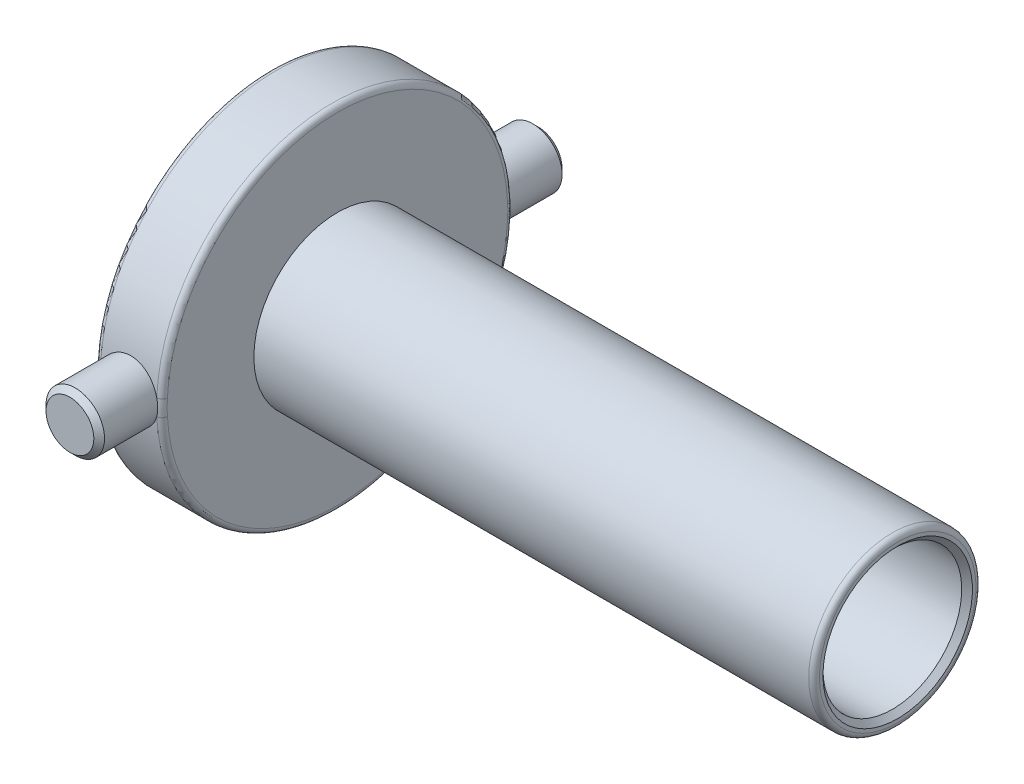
SolidWorks part; units mm, degrees
ref_plane "Front Plane" through (0, 0, 0) normal (0, 0, 1) x (1, 0, 0)
ref_plane "Top Plane" through (0, 0, 0) normal (0, 1, 0) x (1, 0, 0)
ref_plane "Right Plane" through (0, 0, 0) normal (1, 0, 0) x (0, 0, -1)
sketch "Sketch2" plane through (0, 0, 0) normal (0, 0, 1) x (1, 0, 0)
  line L0 (5.08, 5.2705) -> (47.625, 5.2705)
  line L1 (47.625, 5.2705) -> (47.625, 6.35)
  line L2 (47.625, 6.35) -> (5.08, 6.35)
  line L3 (5.08, 5.2705) -> (5.08, 0)
  line L5 (5.08, 0) -> (0, 0)
  line L6 (0, 13.335) -> (0, 0)
  line L7 (0, 0) -> (69.1724, 0) construction
  line L8 (5.08, 6.35) -> (5.08, 13.335)
  line L9 (5.08, 13.335) -> (0, 13.335)
  dimension "D1" = 5.08
  dimension "D2" = 47.625
  dimension "D3" = 10.541
  dimension "D4" = 12.7
  dimension "D5" = 26.67
revolve "Revolve1" add sketch "Sketch2" angle 360 about L7
sketch "Sketch3" plane through (0, 0, 0) normal (0, 0, 1) x (1, 0, 0)
  line L0 (0, 0) -> (5.08, 0) construction
  line L1 (0, 13.335) -> (0, -13.335) construction
  line L2 (5.08, -5.2705) -> (5.08, 5.2705) construction
  circle A0 centre (2.54, 0) radius 2.2225
  dimension "D1" = 4.445
extrude "Boss-Extrude1" add sketch "Sketch3" along normal mid plane 35.56
fillet "Fillet1" radius 0.4064 3 edges at (47.625, 0, 6.35) (0, 0, 13.335) (5.08, 0, 13.335)
chamfer "Chamfer1" distance 0.4064 angle 45 3 edges at (4.7625, 0, -17.78) (4.7625, 0, 17.78) (47.625, 0, 5.2705)
